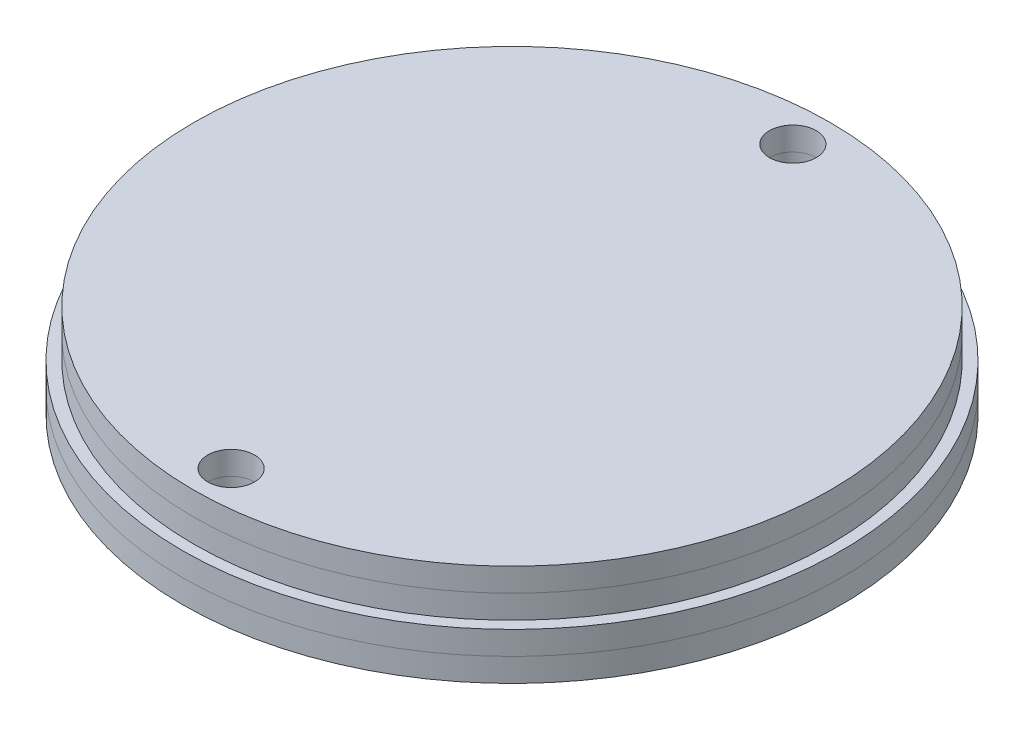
SolidWorks part; units mm, degrees
ref_plane "Front Plane" through (0, 0, 0) normal (0, 0, 1) x (1, 0, 0)
ref_plane "Top Plane" through (0, 0, 0) normal (0, 1, 0) x (1, 0, 0)
ref_plane "Right Plane" through (0, 0, 0) normal (1, 0, 0) x (0, 0, -1)
sketch "Sketch1" plane through (0, 0, 0) normal (0, 1, 0) x (1, 0, 0)
  circle A0 centre (0, 0) radius 43.18
  dimension "D1" = 86.36
extrude "Boss-Extrude1" add sketch "Sketch1" along normal blind 3.175
sketch "Sketch6" plane through (0, 3.175, 0) normal (0, 1, 0) x (1, 0, 0)
  circle A0 centre (0, 0) radius 43.18
extrude "Boss-Extrude3" add sketch "Sketch6" along normal blind 3.175 separate body
sketch "Sketch2" plane through (0, 0, 0) normal (0, 1, 0) x (1, 0, 0)
  circle A0 centre (0, 0) radius 44.704
  dimension "D1" = 89.408
extrude "Boss-Extrude2" add sketch "Sketch2" against normal blind 3.175
sketch "Sketch7" plane through (0, -3.175, 0) normal (0, -1, 0) x (1, 0, 0)
  circle A0 centre (0, 0) radius 44.704
extrude "Boss-Extrude4" add sketch "Sketch7" along normal blind 3.175 separate body
sketch "Sketch4" plane through (0, 0, 0) normal (0, 1, 0) x (1, 0, 0)
  circle A0 centre (0, 0) radius 44.704
  dimension "D1" = 89.408
sketch "Sketch5" plane through (0, 3.175, 0) normal (0, 1, 0) x (1, 0, 0)
  circle A0 centre (0, 38.1) radius 3.175
  dimension "D1" = 6.35
  dimension "D2" = 38.1
extrude "Cut-Extrude2" cut sketch "Sketch5" against normal through all both and the other way through all
mirror "Mirror1" about plane through (0, 0, 0) normal (0, 0, 1) of "Cut-Extrude2"
